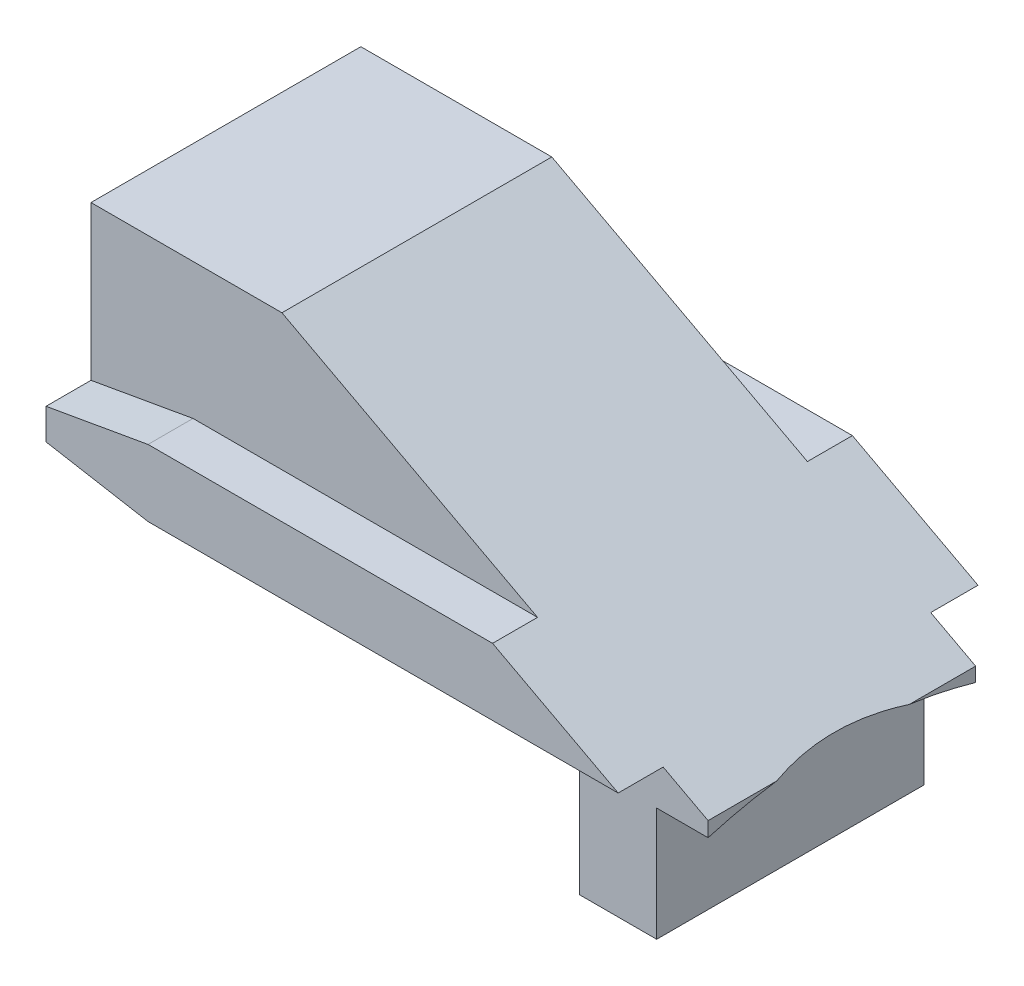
SolidWorks part; units mm, degrees
ref_plane "Front Plane" through (0, 0, 0) normal (0, 0, 1) x (1, 0, 0)
ref_plane "Top Plane" through (0, 0, 0) normal (0, 1, 0) x (1, 0, 0)
ref_plane "Right Plane" through (0, 0, 0) normal (1, 0, 0) x (0, 0, -1)
sketch "Sketch1" plane through (0, 0, 0) normal (0, 0, 1) x (1, 0, 0)
  line L1 (0, 11.71) -> (22.01, 0)
  line L2 (22.01, 0) -> (22.01, -5)
  line L3 (22.01, -5) -> (17.01, -5)
  line L4 (17.01, -5) -> (17.01, 0)
  line L5 (17.01, 0) -> (0, 0)
  line L6 (0, 11.71) -> (-2, 11.71)
  line L7 (-2, 11.71) -> (-2, 0)
  line L8 (-2, 0) -> (0, 0)
  dimension "D1" = 5
  dimension "D2" = 24.01
  dimension "D4" = 5
  dimension "D5" = 11.71
  dimension "D6" = 2
extrude "Boss-Extrude1" add sketch "Sketch1" along normal mid plane 16.15
sketch "Sketch3" plane through (22.01, 0, 0) normal (1, 0, 0) x (0, 0, -1)
  line L0 (-8.075, 0) -> (8.075, 0) construction
  circle A0 centre (0, -18.4) radius 18.58
  dimension "D1" = 37.16
  dimension "D2" = 18.4
extrude "Cut-Extrude1" cut sketch "Sketch3" against normal blind 2
ref_plane "Plane1" through (4.4144, 8.2973, 0) normal (0.4697, 0.8828, 0) x (0.8828, -0.4697, 0)
sketch "Sketch4" plane through (-2, 0, 0) normal (-1, 0, 0) x (0, 0, 1)
  line L0 (-5.25, 11.71) -> (-5.25, 3.53)
  line L1 (-5.25, 3.53) -> (-7, 3.53)
  line L2 (-7, 3.53) -> (-7, 0.93)
  line L3 (-7, 0.93) -> (-5.16, 0.93)
  line L4 (-5.16, 0.93) -> (-5.16, 0)
  line L5 (8.075, 0) -> (-8.075, 0) construction
  line L7 (-8.075, 0) -> (-8.075, 11.71)
  line L8 (-8.075, 11.71) -> (-8.075, 0) construction
  line L9 (-8.075, 11.71) -> (-5.25, 11.71)
  line L10 (8.075, 11.71) -> (-8.075, 11.71) construction
  line L12 (5.25, 0) -> (5.25, 0.93)
  line L13 (5.25, 0.93) -> (7, 0.93)
  line L14 (7, 0.93) -> (7, 3.53)
  line L15 (7, 3.53) -> (5.25, 3.53)
  line L16 (5.25, 3.53) -> (5.25, 11.71)
  line L17 (5.25, 11.71) -> (8.075, 11.71)
  line L18 (8.075, 11.71) -> (8.075, 0)
  line L19 (-8.075, 0) -> (-8.075, -5)
  line L20 (8.075, -5) -> (-8.075, -5) construction
  line L21 (-8.075, -5) -> (-5.16, -5)
  line L22 (-5.16, -5) -> (-5.16, 0)
  line L23 (5.25, 0) -> (5.25, -5)
  line L24 (5.25, -5) -> (8.075, -5)
  line L25 (8.075, -5) -> (8.075, 0)
  dimension "D2" = 2.6
  dimension "D3" = 10.5
  dimension "D4" = 14
  dimension "D5" = 10.41
  dimension "D6" = 8.18
extrude "Cut-Extrude2" cut sketch "Sketch4" against normal up to surface (2 mm away)
chamfer "Chamfer1" distance 0.7 angle 80 4 edges at (-2, 0.93, -6.08) (-2, 3.53, -6.125) (-2, 0.93, 6.125) (-2, 3.53, 6.125)
sketch "Sketch5" plane through (0, 0, -5.25) normal (0, 0, -1) x (-1, 0, 0)
  line L5 (2, 7.71) -> (-7.5184, 7.71)
  line L6 (2, 2.83) -> (2, 11.71) construction
  line L7 (0, 11.71) -> (-15.375, 3.53) construction
  line L8 (-7.5184, 7.71) -> (2, 12.7741)
  line L9 (2, 12.7741) -> (2, 7.71)
  line L10 (0, 11.71) -> (2, 11.71) construction
  dimension "D1" = 4
extrude "Cut-Extrude3" cut sketch "Sketch5" against normal through all
scale "Scale1" scale about centroid uniform scaling yes scale factor 0.9
sketch "Sketch6" plane through (0, 0, -4.7239) normal (0, 0, -1) x (-1, 0, 0)
  line L0 (-7.5813, 7.2038) -> (-5.7017, 8.2038)
  line L1 (-5.7017, 8.2038) -> (0.9853, 8.2038)
  line L2 (0.9853, 8.2038) -> (0.9853, 7.2038)
  line L3 (0.9853, 7.2038) -> (-7.5813, 7.2038)
  line L4 (-7.5813, 7.2038) -> (-14.6523, 3.4418) construction
  dimension "D1" = 1
extrude "Boss-Extrude2" add sketch "Sketch6" against normal up to surface (9.45 mm away)
